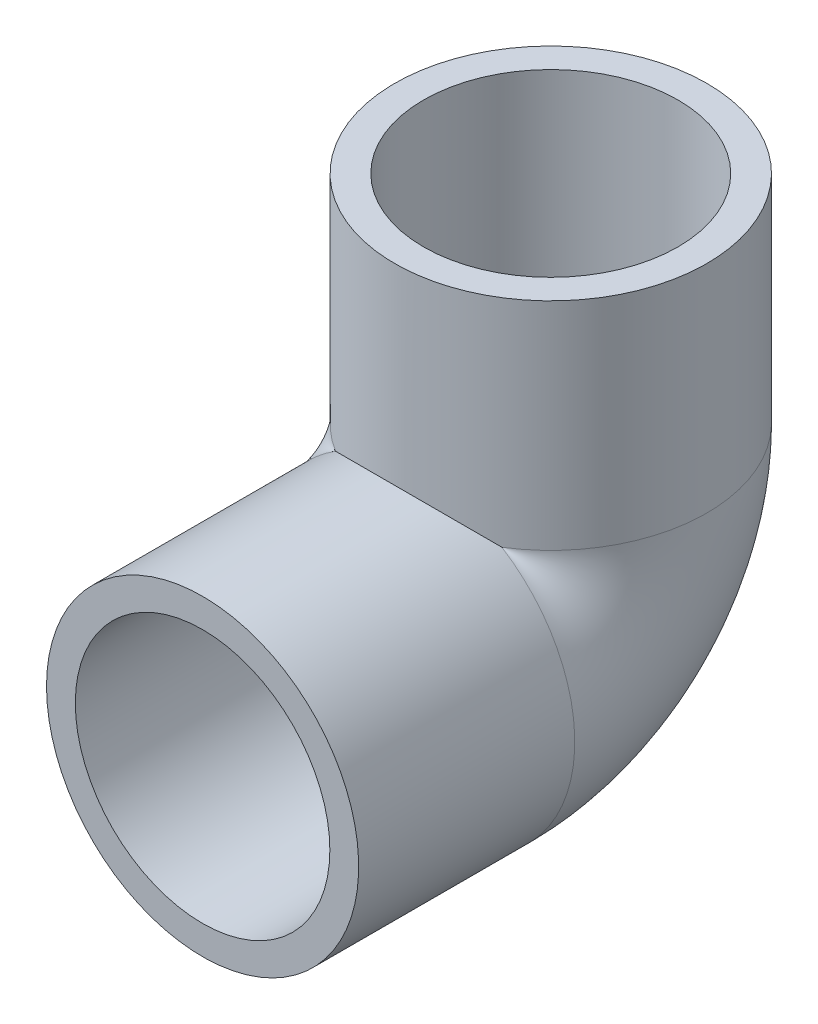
SolidWorks part; units mm, degrees
ref_plane "Front Plane" through (0, 0, 0) normal (0, 0, 1) x (1, 0, 0)
ref_plane "Top Plane" through (0, 0, 0) normal (0, 1, 0) x (1, 0, 0)
ref_plane "Right Plane" through (0, 0, 0) normal (1, 0, 0) x (0, 0, -1)
sketch "Sketch1" plane through (0, 0, 0) normal (1, 0, 0) x (0, 0, -1)
  line L0 (0, 0) -> (0, 46.0375) construction
  line L1 (0, 0) -> (-46.0375, 0) construction
  line L2 (-46.0375, 20.6375) -> (-46.0375, -20.6375) construction
  line L3 (-20.6375, 46.0375) -> (20.6375, 46.0375) construction
  line L4 (-16.8275, 17.4625) -> (16.8275, 17.4625) construction
  line L5 (-17.4625, 16.8275) -> (-17.4625, -16.8275) construction
  line L6 (0, -13.1191) -> (-17.4625, -13.1191) construction
  line L7 (-8.7313, 13.1191) -> (-8.7313, -13.1191) construction
  line L8 (13.1191, 17.4625) -> (13.1191, 0) construction
  line L9 (-13.1191, 8.7312) -> (13.1191, 8.7313) construction
  point P3 (-17.4625, 0)
  point P5 (0, 17.4625)
  point P9 (-46.0375, 0)
  point P12 (0, 46.0375)
  point P15 (0, 17.4625)
  point P18 (-17.4625, 0)
  point P24 (-8.7313, 0)
  point P29 (0, 8.7312)
sketch "Sketch2" plane through (0, 0, 0) normal (1, 0, 0) x (0, 0, -1)
  line L0 (-46.0375, 20.6375) -> (-17.4625, 20.6375)
  line L1 (-17.4625, 20.6375) -> (-17.4625, 16.8275)
  line L2 (-17.4625, 16.8275) -> (-46.0375, 16.8275)
  line L3 (-46.0375, 20.6375) -> (-46.0375, -20.6375) construction
  line L4 (-46.0375, 16.8275) -> (-46.0375, 20.6375)
revolve "Revolve1" add sketch "Sketch2" angle 360 about L1
sketch "Sketch3" plane through (0, 0, 0) normal (1, 0, 0) x (0, 0, -1)
  line L0 (20.6375, 46.0375) -> (20.6375, 17.4625)
  line L1 (20.6375, 17.4625) -> (16.8275, 17.4625)
  line L2 (16.8275, 17.4625) -> (16.8275, 46.0375)
  line L3 (-20.6375, 46.0375) -> (20.6375, 46.0375) construction
  line L4 (16.8275, 46.0375) -> (20.6375, 46.0375)
revolve "Revolve2" add sketch "Sketch3" angle 360 about L0
sketch "Sketch4" plane through (0, 0, 0) normal (1, 0, 0) x (0, 0, -1)
  line L0 (0, 0) -> (-46.0375, 0) construction
  arc A0 (-17.4625, 0) -> (0, 17.4625) centre (-17.4625, 17.4625) ccw
sketch "Sketch5" plane through (0, 0, 17.4625) normal (0, 0, -1) x (-1, 0, 0)
  line L1 (10.9985, 17.4625) -> (-10.9985, 17.4625)
  line L2 (10.9985, 17.4625) -> (-10.9985, 17.4625)
  circle A0 centre (0, 0) radius 13.1191
  arc A4 (-10.9985, 17.4625) -> (10.9985, 17.4625) centre (0, 0) ccw
  arc A5 (-10.9985, 17.4625) -> (10.9985, 17.4625) centre (0, 0) ccw
  dimension "D1" = 0
sweep "Sweep1" add profiles "Sketch5" path "Sketch4"
sketch "Sketch7" plane through (0, 0, 0) normal (1, 0, 0) x (0, 0, -1)
  line L0 (-46.0375, 16.8275) -> (-17.4625, 16.8275)
  line L1 (-17.4625, 16.8275) -> (-17.4625, 13.1191)
  line L3 (-46.0375, -16.8275) -> (-17.4625, -16.8275)
  line L4 (-17.4625, -16.8275) -> (-17.4625, -13.1191)
  line L6 (-13.1191, 17.4625) -> (-16.8275, 17.4625)
  line L7 (-16.8275, 17.4625) -> (-16.8275, 46.0375)
  line L8 (16.8275, 46.0375) -> (16.8275, 17.4625)
  line L9 (16.8275, 17.4625) -> (13.1191, 17.4625)
  line L12 (-46.0375, 20.6375) -> (-46.0375, -20.6375) construction
  line L13 (-20.6375, 46.0375) -> (20.6375, 46.0375) construction
  line L14 (-17.4625, 16.8275) -> (-17.4625, -16.8275) construction
  line L15 (-16.8275, 17.4625) -> (16.8275, 17.4625) construction
  arc A0 (-17.4625, 13.1191) -> (-13.1191, 17.4625) centre (-17.4625, 17.4625) ccw
  arc A1 (-17.4625, -13.1191) -> (13.1191, 17.4625) centre (-17.4625, 17.4625) ccw
sketch "Sketch8" plane through (0, 0, 46.0375) normal (0, 0, 1) x (1, 0, 0)
  line L0 (-20.6375, 46.0375) -> (20.6375, 46.0375) construction
  circle A0 centre (0, 0) radius 16.8275 construction
  circle A1 centre (0, 0) radius 16.8275
  point P3 (0, -16.8275)
  point P4 (16.8275, 0)
  point P5 (-16.8275, 0)
  point P6 (0, 16.8275)
  point P10 (0, 46.0375)
equation "\"D1@Sketch8\"=\"Elbow OD@Sketch1\""
